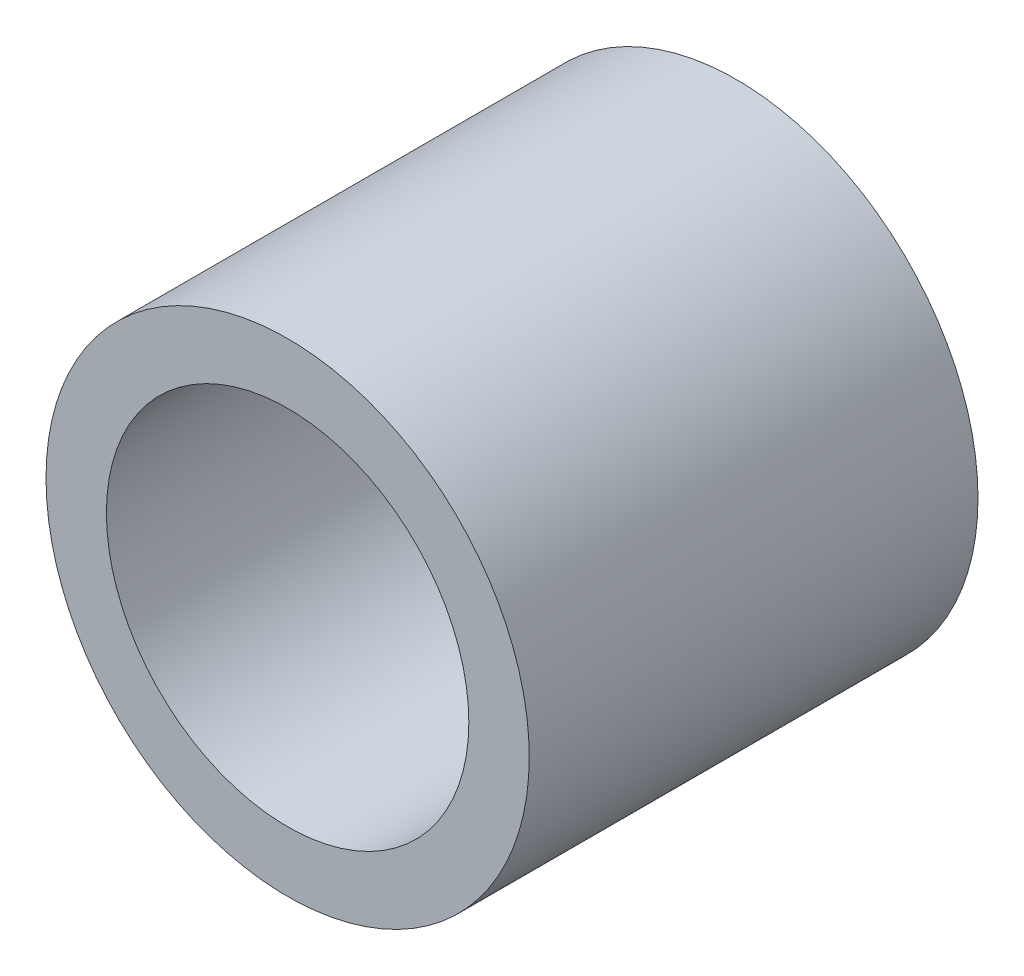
SolidWorks part; units mm, degrees
ref_plane "Plan de face" through (0, 0, 0) normal (0, 0, 1) x (1, 0, 0)
ref_plane "Plan de dessus" through (0, 0, 0) normal (0, 1, 0) x (1, 0, 0)
ref_plane "Plan de droite" through (0, 0, 0) normal (1, 0, 0) x (0, 0, -1)
sketch "Esquisse1" plane through (0, 0, 0) normal (0, 0, 1) x (1, 0, 0)
  circle A0 centre (0, 0) radius 5.25
  circle A1 centre (0, 0) radius 7
  dimension "D1" = 14
  dimension "D2" = 10.5
extrude "Extrusion1" add sketch "Esquisse1" along normal blind 13
